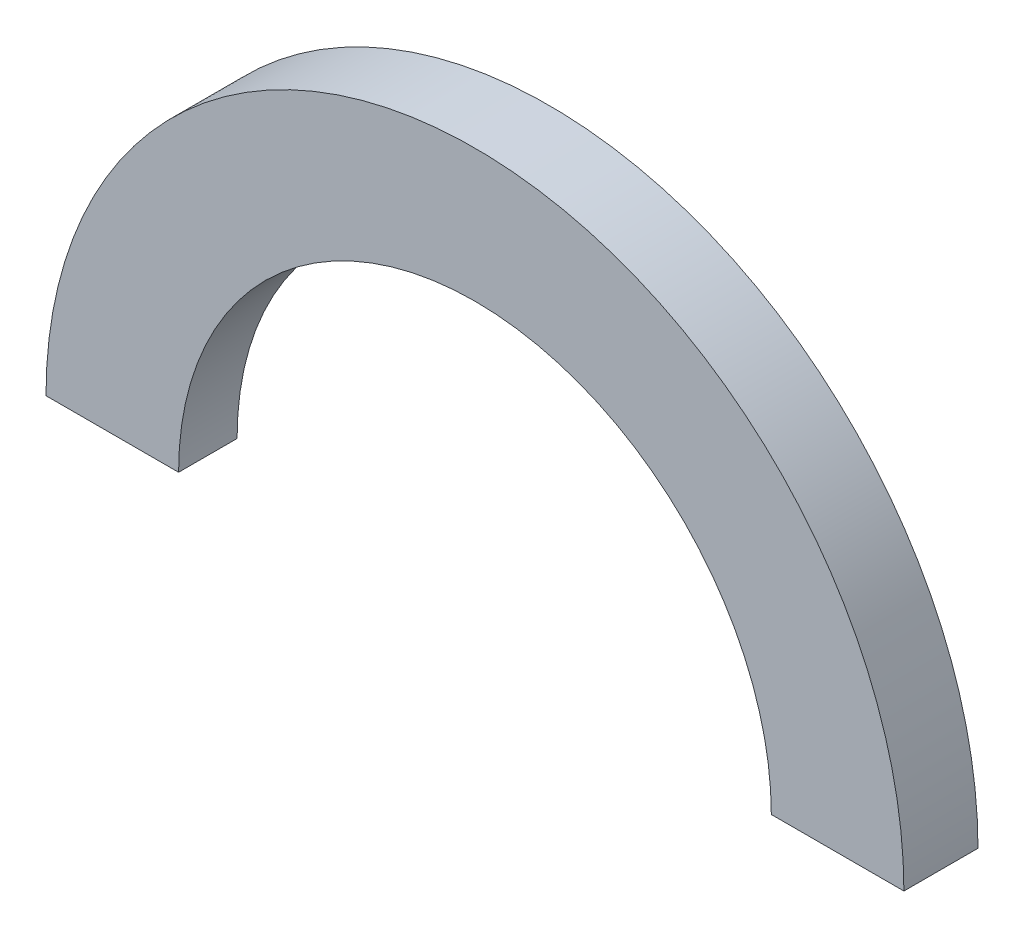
SolidWorks part; units mm, degrees
ref_plane "Face" through (0, 0, 0) normal (0, 0, 1) x (1, 0, 0)
ref_plane "Dessus" through (0, 0, 0) normal (0, 1, 0) x (1, 0, 0)
ref_plane "Droite" through (0, 0, 0) normal (1, 0, 0) x (0, 0, -1)
sketch "Esquisse1" plane through (0, 0, 0) normal (0, 0, 1) x (1, 0, 0)
  circle A0 centre (0, 0) radius 55
  circle A1 centre (0, 0) radius 38
  dimension "D1" = 110
  dimension "D2" = 76
extrude "Extrusion1" add sketch "Esquisse1" along normal blind 9.5
sketch "Esquisse2" plane through (0, 0, 0) normal (0, 0, 1) x (1, 0, 0)
  circle A0 centre (0, 0) radius 41
  dimension "D1" = 82
extrude "Enlèv. mat.-Extru.1" cut sketch "Esquisse2" along normal blind 2
sketch "Esquisse3" plane through (0, 0, 9.5) normal (0, 0, 1) x (1, 0, 0)
  line L1 (-60.0067, -63.5654) -> (67.6149, -63.5654)
  line L2 (-60.0067, -63.5654) -> (-60.0067, 0)
  line L3 (-60.0067, 0) -> (67.6149, 0)
  line L4 (67.6149, -63.5654) -> (67.6149, 0)
extrude "Enlèv. mat.-Extru.2" cut sketch "Esquisse3" against normal through all
